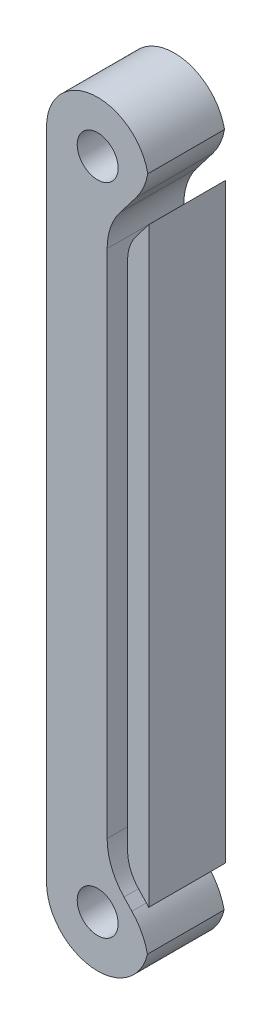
SolidWorks part; units mm, degrees
ref_plane "Front Plane" through (0, 0, 0) normal (0, 0, 1) x (1, 0, 0)
ref_plane "Top Plane" through (0, 0, 0) normal (0, 1, 0) x (1, 0, 0)
ref_plane "Right Plane" through (0, 0, 0) normal (1, 0, 0) x (0, 0, -1)
sketch "Sketch1" plane through (0, 0, 0) normal (0, 0, 1) x (1, 0, 0)
  line L2 (-6.35, -40.64) -> (-6.35, 40.64)
  line L4 (6.35, -40.64) -> (6.35, 40.64)
  line L5 (-6.35, -40.64) -> (6.35, 40.64) construction
  line L6 (-6.35, 40.64) -> (6.35, -40.64) construction
  arc A0 (6.35, 40.64) -> (-6.35, 40.64) centre (0, 40.64) ccw
  arc A1 (6.35, -40.64) -> (-6.35, -40.64) centre (0, -40.64) cw
  circle A2 centre (0, 40.64) radius 2.54
  circle A3 centre (0, -40.64) radius 2.54
  point P0 (0, 0)
  dimension "D3" = 5.08
  dimension "D4" = 5.08
  dimension "D1" = 81.28
  dimension "D2" = 12.7
extrude "Boss-Extrude1" add sketch "Sketch1" along normal blind 9.525
sketch "Sketch2" plane through (0, 0, 9.525) normal (0, 0, 1) x (1, 0, 0)
  line L0 (4.7781, 38.5889) -> (2.7487, 35.941)
  line L1 (1.1768, 31.3058) -> (1.1768, -32.1475)
  line L2 (3.2686, -37.392) -> (4.2581, -38.435)
  line L4 (6.35, 43.2241) -> (8.89, 43.2241)
  line L6 (5.1114, -35.6438) -> (6.1009, -36.6868)
  line L7 (3.7168, 31.3058) -> (3.7168, -32.1475)
  line L8 (6.7941, 37.0439) -> (4.7647, 34.3959)
  line L10 (6.35, -43.6794) -> (8.89, -43.6794)
  line L13 (8.89, -43.6794) -> (8.89, -51.0436) construction
  line L14 (6.35, -43.6794) -> (6.35, -51.0436) construction
  line L15 (6.35, 43.2241) -> (6.35, 45.4184) construction
  line L16 (8.89, 43.2241) -> (8.89, 45.4184) construction
  arc A0 (1.1768, -32.1475) -> (3.2686, -37.392) centre (8.7968, -32.1475) ccw
  arc A1 (2.7487, 35.941) -> (1.1768, 31.3058) centre (8.7968, 31.3058) ccw
  arc A2 (4.7781, 38.5889) -> (6.35, 43.2241) centre (-1.27, 43.2241) ccw
  arc A3 (4.2581, -38.435) -> (6.35, -43.6794) centre (-1.27, -43.6794) cw
  arc A4 (6.1009, -36.6868) -> (8.89, -43.6794) centre (-1.27, -43.6794) cw
  arc A5 (3.7168, -32.1475) -> (5.1114, -35.6438) centre (8.7968, -32.1475) ccw
  arc A6 (4.7647, 34.3959) -> (3.7168, 31.3058) centre (8.7968, 31.3058) ccw
  arc A7 (6.7941, 37.0439) -> (8.89, 43.2241) centre (-1.27, 43.2241) ccw
  point P13 (6.35, 40.64)
  point P17 (6.35, -40.64)
  dimension "D1" = 7.62
  dimension "D2" = 7.62
  dimension "D3" = 2.54
extrude "Cut-Extrude1" cut sketch "Sketch2" against normal blind 10.16
